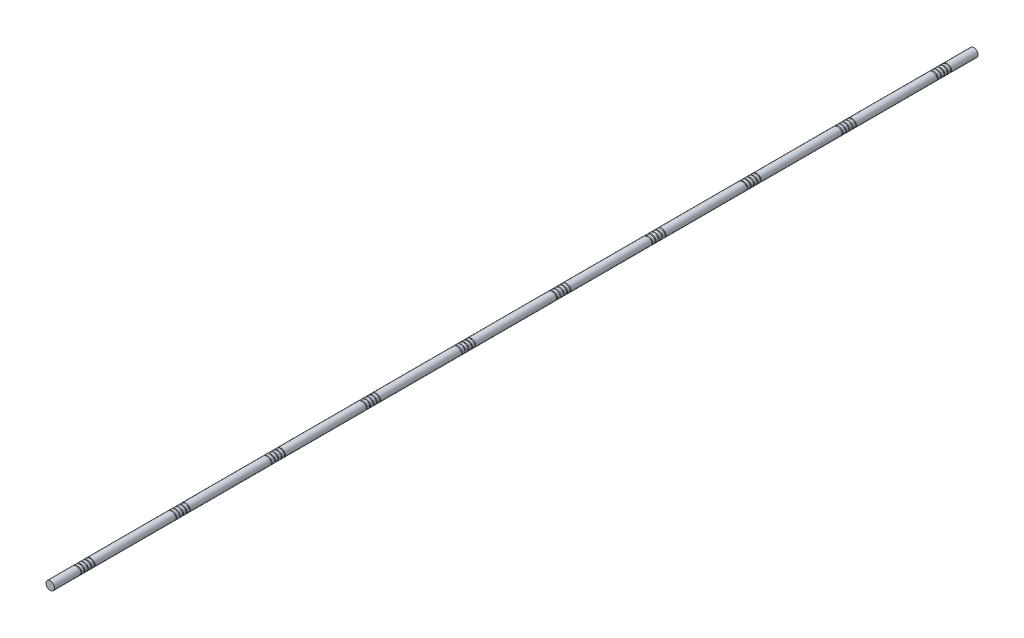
SolidWorks part; units mm, degrees
ref_plane "Front Plane" through (0, 0, 0) normal (0, 0, 1) x (1, 0, 0)
ref_plane "Top Plane" through (0, 0, 0) normal (0, 1, 0) x (1, 0, 0)
ref_plane "Right Plane" through (0, 0, 0) normal (1, 0, 0) x (0, 0, -1)
sketch "Sketch1" plane through (0, 0, 0) normal (0, 0, 1) x (1, 0, 0)
  circle A0 centre (0, 0) radius 25
  dimension "D1" = 50
extrude "Boss-Extrude1" add sketch "Sketch1" along normal blind 5500
ref_plane "Plane1" through (0, 0, 150) normal (0, 0, 1) x (1, 0, 0)
sketch "Sketch2" plane through (0, 0, 150) normal (0, 0, 1) x (1, 0, 0)
  circle A0 centre (0, 0) radius 27.1167
  dimension "D1" = 54.2333
curve "Helix/Spiral1"
sketch "Sketch3" plane through (0, 0, 0) normal (0, 1, 0) x (1, 0, 0)
  circle A0 centre (-27.1167, -150) radius 3.175
  spline S0 degree 3 number of poles 118 (-27.1167, -150) -> (-27.1167, -250) construction
  dimension "D1" = 6.35
sweep "Cut-Sweep1" cut profiles "Sketch3" path "Helix/Spiral1"
pattern_linear "LPattern1" count 10 spacing 566.6667 along (0, 0, -1) of "Cut-Sweep1"
